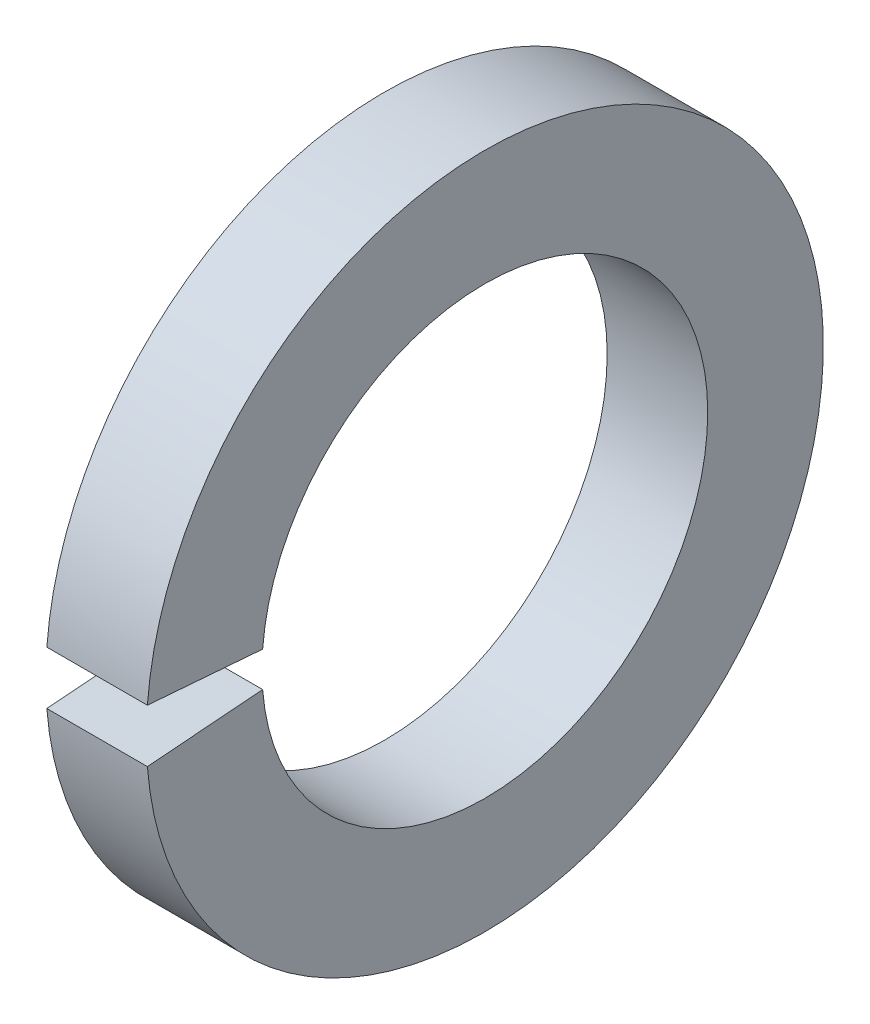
SolidWorks part; units mm, degrees
ref_plane "Plane1" through (0, 0, 0) normal (0, 0, 1) x (1, 0, 0)
ref_plane "Plane2" through (0, 0, 0) normal (0, 1, 0) x (1, 0, 0)
ref_plane "Plane3" through (0, 0, 0) normal (1, 0, 0) x (0, 0, -1)
sketch "Sketch1" plane through (0, 0, 0) normal (0, 0, 1) x (1, 0, 0)
  line L0 (-34.925, 0) -> (9.525, 0) construction
  line L1 (0, 1.6891) -> (0, 2.5654)
  line L2 (0, 2.5654) -> (-0.762, 2.5654)
  line L3 (-0.762, 2.5654) -> (-0.762, 1.6891)
  line L4 (-0.762, 1.6891) -> (0, 1.6891)
  dimension "Thickness" = 0.762
  dimension "Inside_dia" = 3.3782
  dimension "Outside_dia" = 5.1308
revolve "Base-Revolve" add sketch "Sketch1" angle 360 about L0
sketch "Sketch2" plane through (0, 0, 0) normal (-1, 0, 0) x (0, -1, 0)
  line L0 (0, 0) -> (0.2053, 2.6086)
  line L1 (0, -3.175) -> (0, 12.7) construction
  line L2 (0, 0) -> (-0.2053, 2.6086)
  arc A0 (0.2053, 2.6086) -> (-0.2053, 2.6086) centre (0, 0) ccw
  dimension "D1" = 2.6167
  dimension "Gap_ang" = 9
extrude "Gap" cut sketch "Sketch2" along normal through all
equation "\"D1@Sketch2\" = \"Outside_dia@Sketch1\" * 0.51"
